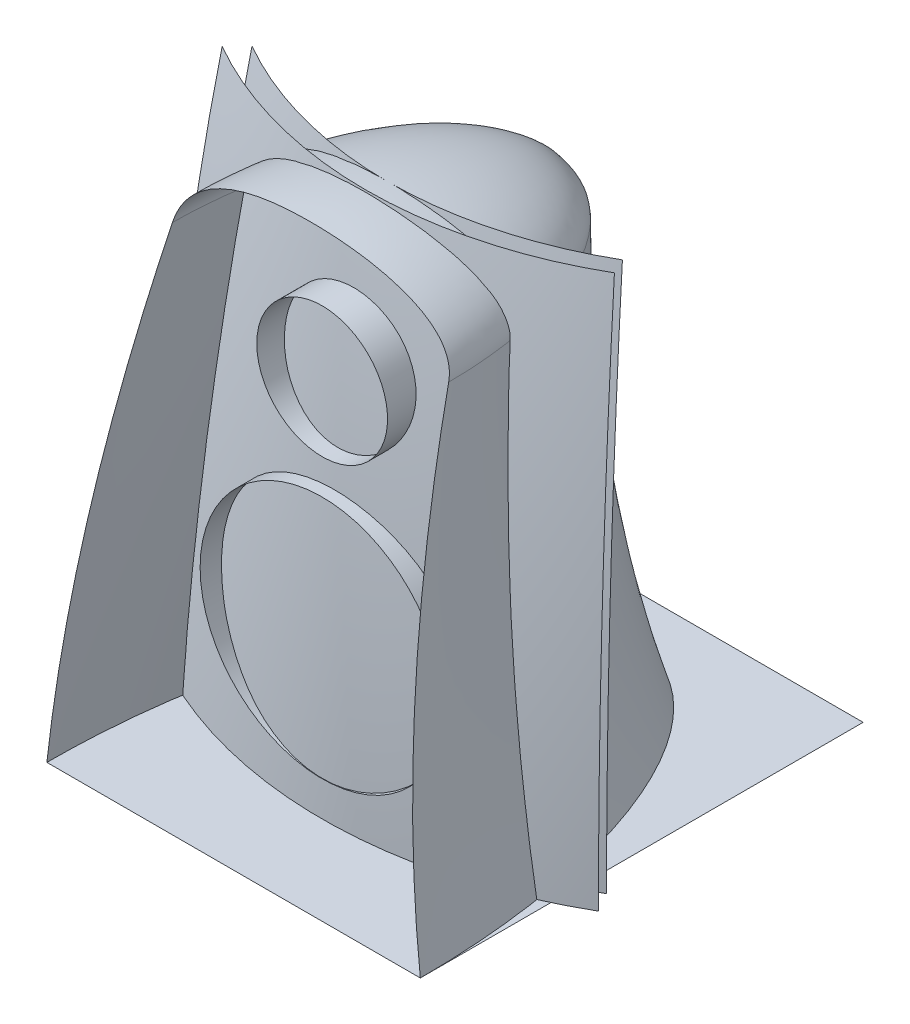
SolidWorks part; units mm, degrees
ref_plane "Front Plane" through (0, 0, 0) normal (0, 0, 1) x (1, 0, 0)
ref_plane "Top Plane" through (0, 0, 0) normal (0, 1, 0) x (1, 0, 0)
ref_plane "Right Plane" through (0, 0, 0) normal (1, 0, 0) x (0, 0, -1)
sketch "Sketch1" plane through (0, 0, 0) normal (1, 0, 0) x (0, 0, -1)
  line L0 (250, 0) -> (250, 300) construction
  arc A0 (0, 0) -> (25, 300) centre (1812.5, 0) cw
  dimension "D1" = 300
  dimension "D2" = 25
  dimension "D3" = 250
surface "Face of Baffle" sketch "Sketch1" parameters "D1"=60
sketch "Sketch2" plane through (0, 0, 0) normal (0, 1, 0) x (1, 0, 0)
  line L0 (0, 0) -> (0, 177.8) construction
  arc A1 (-125, 33.4936) -> (125, 33.4936) centre (0, 250) ccw construction
  ellipse E0 centre (0, -50.8) end of major axis (0, 177.8) minor radius 107.1101 (107.1101, -50.8) -> (-107.1101, -50.8) ccw
  point P3 (-101.6, 21.5762)
  dimension "D1" = 177.8
  dimension "D2" = 50.8
  dimension "D3" = 203.2
ref_plane "Housing Loft Top" through (0, 260, 0) normal (0, 1, 0) x (-1, 0, 0)
sketch "Sketch3" plane through (0, 260, 152.4) normal (0, -1, 0) x (-1, 0, 0)
  line L0 (0, 171.1452) -> (0, 285.4452) construction
  arc A1 (-115.6274, 202.1275) -> (115.6274, 202.1275) centre (0, 402.4) ccw
  arc A2 (-115.6274, 202.1275) -> (115.6274, 202.1275) centre (0, 402.4) ccw construction
  ellipse E0 centre (0, 145.7452) end of major axis (0, 6.0452) minor radius 79.2385 (79.2385, 145.7452) -> (-79.2385, 145.7452) ccw
  point P3 (-76.2, 184.06)
  dimension "D1" = 114.3
  dimension "D2" = 152.4
  dimension "D3" = 25.4
sketch "Sketch4" plane through (0, 0, 0) normal (1, 0, 0) x (0, 0, -1)
  line L0 (133.0452, 260) -> (133.0452, 394.4787) construction
  arc A0 (177.8, 0) -> (133.0452, 260) centre (910.649, 260) cw
surface "Housing Loft"
sketch "Sketch6" plane through (0, 260, 0) normal (0, 1, 0) x (-1, 0, 0)
  line L0 (0, 0) -> (0, -303.7299) construction
  spline S1 degree 3 poles (-1174.8258, -1390.9255) (-509.0143, 656.6502) (100.0536, 308.3984) (78.3433, -15.2294) (77.1144, -26.1164) (75.3736, -36.9329) (73.1048, -47.6527) (70.2774, -58.2378) (66.8609, -68.6499) (62.8078, -78.8313) (58.0646, -88.7122) (52.5617, -98.1936) (46.2177, -107.1386) (40.1534, -113.9818) (34.7916, -118.947) (30.5099, -122.3659) (25.9626, -125.4297) (21.1611, -128.0726) (16.1168, -130.2285) (10.8737, -131.833) (5.4757, -132.8214) (1.8255, -133.0452) (-1.8255, -133.0452) (-5.4757, -132.8214) (-10.8737, -131.833) (-16.1169, -130.2285) (-21.1612, -128.0725) (-25.9627, -125.4297) (-30.51, -122.3659) (-34.7917, -118.9469) (-40.1535, -113.9817) (-46.2178, -107.1385) (-52.5618, -98.1935) (-58.0647, -88.7121) (-62.8078, -78.8311) (-66.8609, -68.6498) (-70.2774, -58.2377) (-73.1048, -47.6526) (-75.3736, -36.9328) (-77.1144, -26.1163) (-78.3433, -15.2294) (-100.0537, 308.4006) (509.0229, 656.6543) (1174.8308, -1390.912) knots -2.681818 -2.681818 -2.681818 -2.681818 0.03125 0.0625 0.09375 0.125 0.15625 0.1875 0.21875 0.25 0.28125 0.3125 0.34375 0.375 0.390625 0.40625 0.421875 0.4375 0.453125 0.46875 0.484375 0.5 0.5 0.515625 0.53125 0.546875 0.5625 0.578125 0.59375 0.609375 0.625 0.65625 0.6875 0.71875 0.75 0.78125 0.8125 0.84375 0.875 0.90625 0.9375 0.96875 3.681845 3.681845 3.681845 3.681845 only from (79.2385, 6.6548) to (-79.2385, 6.6548) construction
  spline S2 degree 3 poles (0, -133.0452) (-1.8255, -133.0452) (-5.4757, -132.8214) (-10.8737, -131.833) (-16.1169, -130.2285) (-21.1612, -128.0725) (-25.9627, -125.4297) (-30.51, -122.3659) (-34.7917, -118.9469) (-40.1535, -113.9817) (-46.2178, -107.1385) (-52.5618, -98.1935) (-58.0647, -88.7121) (-62.8078, -78.8311) (-66.8609, -68.6498) (-70.2774, -58.2377) (-73.1048, -47.6526) (-75.3736, -36.9328) (-77.1144, -26.1163) (-78.3433, -15.2294) (-79.0766, -4.2983) (-79.2385, 3.0038) (-79.2385, 6.6548) knots 0.5 0.5 0.5 0.5 0.515625 0.53125 0.546875 0.5625 0.578125 0.59375 0.609375 0.625 0.65625 0.6875 0.71875 0.75 0.78125 0.8125 0.84375 0.875 0.90625 0.9375 0.96875 1 1 1 1
sketch "Sketch7" plane through (0, 260, 0) normal (0, -1, 0) x (1, 0, 0)
  line L0 (0, 0) -> (0, -303.7299) construction
  spline S2 degree 3 poles (0, -133.0452) (-1.8255, -133.0452) (-5.4757, -132.8214) (-10.8737, -131.833) (-16.1169, -130.2285) (-21.1612, -128.0725) (-25.9627, -125.4297) (-30.51, -122.3659) (-34.7917, -118.9469) (-40.1535, -113.9817) (-46.2178, -107.1385) (-52.5618, -98.1935) (-58.0647, -88.7121) (-62.8078, -78.8311) (-66.8609, -68.6498) (-70.2774, -58.2377) (-73.1048, -47.6526) (-75.3736, -36.9328) (-77.1144, -26.1163) (-78.3433, -15.2294) (-79.0766, -4.2983) (-79.2385, 3.0038) (-79.2385, 6.6548) knots 0.5 0.5 0.5 0.5 0.515625 0.53125 0.546875 0.5625 0.578125 0.59375 0.609375 0.625 0.65625 0.6875 0.71875 0.75 0.78125 0.8125 0.84375 0.875 0.90625 0.9375 0.96875 1 1 1 1
sketch "Sketch8" plane through (0, 0, 0) normal (1, 0, 0) x (0, 0, -1)
  line L0 (0, 260) -> (303.7299, 260) construction
  ellipse E0 centre (-6.6548, 260) end of major axis (-146.3548, 260) minor radius 40 (133.0452, 260) -> (-6.6548, 300) ccw
surface "Housing Cap"
surface "Inside of Baffle" parameters "D1"=12.7
sketch "Sketch9" plane through (0, 0, 0) normal (0, 1, 0) x (1, 0, 0)
  line L0 (107.1101, 177.8) -> (-107.1101, 177.8) construction
  line L1 (-107.1101, -50.8) -> (107.1101, -50.8)
  line L2 (-107.1101, -50.8) -> (-107.1101, 203.2)
  line L3 (-107.1101, 203.2) -> (107.1101, 203.2)
  line L4 (107.1101, -50.8) -> (107.1101, 203.2)
  spline S1 degree 3 poles (107.1101, -50.8) (107.1101, -45.1256) (106.9122, -33.7767) (106.0187, -16.7743) (104.5175, 0.1854) (102.3904, 17.0783) (99.6101, 33.8764) (96.139, 50.546) (91.9264, 67.0446) (86.9057, 83.3167) (80.9884, 99.2862) (74.0574, 114.8462) (65.9568, 129.8349) (58.0586, 141.6432) (50.9163, 150.472) (45.1082, 156.7015) (38.8113, 162.441) (31.9936, 167.5553) (24.6422, 171.8766) (16.784, 175.2011) (8.5112, 177.3153) (2.8372, 177.8) (-2.8372, 177.8) (-8.5112, 177.3153) (-16.784, 175.2011) (-24.6423, 171.8766) (-31.9937, 167.5552) (-38.8114, 162.4409) (-45.1083, 156.7014) (-50.9164, 150.4719) (-58.0587, 141.6431) (-65.957, 129.8347) (-74.0575, 114.846) (-80.9885, 99.286) (-86.9057, 83.3165) (-91.9265, 67.0444) (-96.139, 50.5458) (-99.6102, 33.8763) (-102.3905, 17.0782) (-104.5176, 0.1853) (-106.0187, -16.7744) (-106.9122, -33.7768) (-107.1101, -45.1256) (-107.1101, -50.8) knots 0 0 0 0 0.03125 0.0625 0.09375 0.125 0.15625 0.1875 0.21875 0.25 0.28125 0.3125 0.34375 0.375 0.390625 0.40625 0.421875 0.4375 0.453125 0.46875 0.484375 0.5 0.5 0.515625 0.53125 0.546875 0.5625 0.578125 0.59375 0.609375 0.625 0.65625 0.6875 0.71875 0.75 0.78125 0.8125 0.84375 0.875 0.90625 0.9375 0.96875 1 1 1 1 construction
  dimension "D1" = 25.4
surface "Base" sketch "Sketch9"
sketch "Sketch10" plane through (0, 0, 0) normal (0, 0, 1) x (1, 0, 0)
  circle A0 centre (0, 90) radius 70
  circle A1 centre (0, 217.5) radius 37.5
  dimension "D2" = 140
  dimension "D3" = 20
  dimension "D4" = 75
  dimension "D1" = 20
surface "Driver Mounts" sketch "Sketch10" parameters "D1"=76.2
surface "Surface-Knit1"
